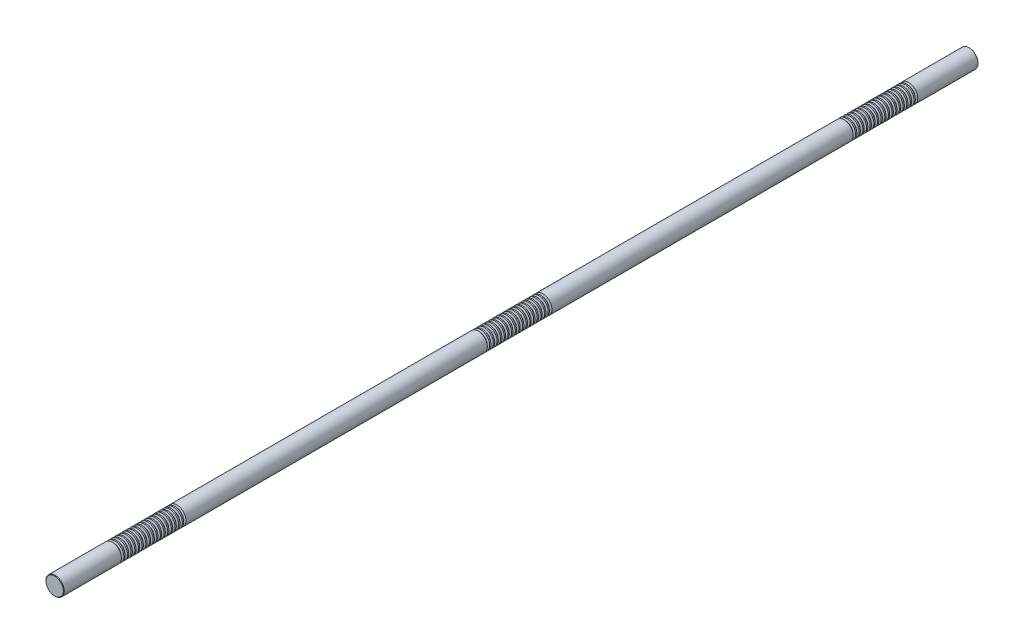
SolidWorks part; units mm, degrees
ref_plane "Front Plane" through (0, 0, 0) normal (0, 0, 1) x (1, 0, 0)
ref_plane "Top Plane" through (0, 0, 0) normal (0, 1, 0) x (1, 0, 0)
ref_plane "Right Plane" through (0, 0, 0) normal (1, 0, 0) x (0, 0, -1)
sketch "Sketch1" plane through (0, 0, 0) normal (0, 0, 1) x (1, 0, 0)
  circle A0 centre (0, 0) radius 15
  dimension "D1" = 30
extrude "Boss-Extrude1" add sketch "Sketch1" along normal mid plane 1500
chamfer "Chamfer1" distance 0.75 angle 45 2 edges at (15, 0, -750) (15, 0, 750)
sketch "Sketch2" plane through (0, 0, 0) normal (1, 0, 0) x (0, 0, -1)
  line L0 (650.4689, 15) -> (646.5311, 15)
  line L1 (749.25, 15) -> (-749.25, 15) construction
  line L2 (646.5311, 15) -> (647.4689, 11.5)
  line L3 (647.4689, 11.5) -> (649.5311, 11.5)
  line L4 (649.5311, 11.5) -> (650.4689, 15)
  line L5 (750, -14.25) -> (750, 14.25) construction
  point P4 (648.5, 15)
  point P7 (648.5, 11.5)
  point P8 (650, 13.25)
  point P9 (647, 13.25)
  dimension "D1" = 3
  dimension "D2" = 100
  dimension "D3" = 3.5
  dimension "D4" = 30
revolve "Cut-Revolve1" cut sketch "Sketch2" angle 360 about axis through (0, 0, 750) along (0, 0, -1)
pattern_linear "LPattern1" count 18 spacing 6 along (0, 0, 1) of "Cut-Revolve1"
pattern_linear "LPattern2" count 3 spacing 600 along (0, 0, 1) of "Cut-Revolve1", "LPattern1"
